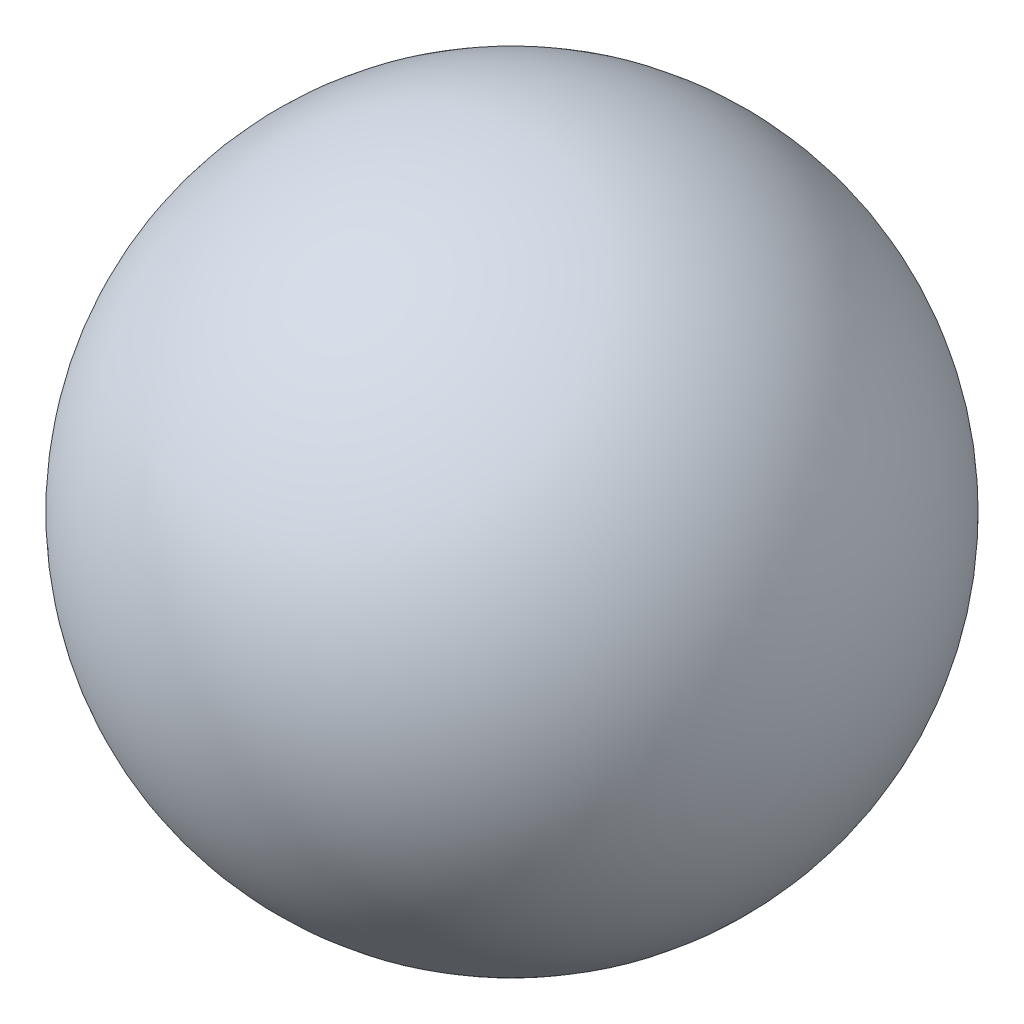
SolidWorks part; units mm, degrees
ref_plane "Front Plane" through (0, 0, 0) normal (0, 0, 1) x (1, 0, 0)
ref_plane "Top Plane" through (0, 0, 0) normal (0, 1, 0) x (1, 0, 0)
ref_plane "Right Plane" through (0, 0, 0) normal (1, 0, 0) x (0, 0, -1)
sketch "Sketch1" plane through (0, 0, 0) normal (0, 0, 1) x (1, 0, 0)
  line L0 (0, 64) -> (0, 67.5)
  line L1 (0, -65.8122) -> (15, -65.8122) construction
  line L2 (0, -64) -> (0, -65.8122) construction
  line L3 (0, -64) -> (0, 64) construction
  line L4 (15, -65.8122) -> (15, -62.2174)
  arc A0 (0, 67.5) -> (15, -65.8122) centre (0, 0) ccw construction
  arc A1 (15, -65.8122) -> (0, 67.5) centre (0, 0) ccw
  arc A2 (0, 64) -> (0, -64) centre (0, 0) ccw construction
  arc A3 (0, -64) -> (15, -62.2174) centre (0, 0) ccw construction
  arc A4 (15, -62.2174) -> (0, 64) centre (0, 0) ccw
  dimension "D2" = 15
  dimension "D1" = 67.5
  dimension "D3" = 3.5
revolve "Revolve1" add sketch "Sketch1" angle 360 about L3
equation "\"Outer Diameter\"= 6.5"
equation "\"Thickness of Orb\"= 1 / 4"
equation "\"Light Opening\"= 1.5 / 2"
